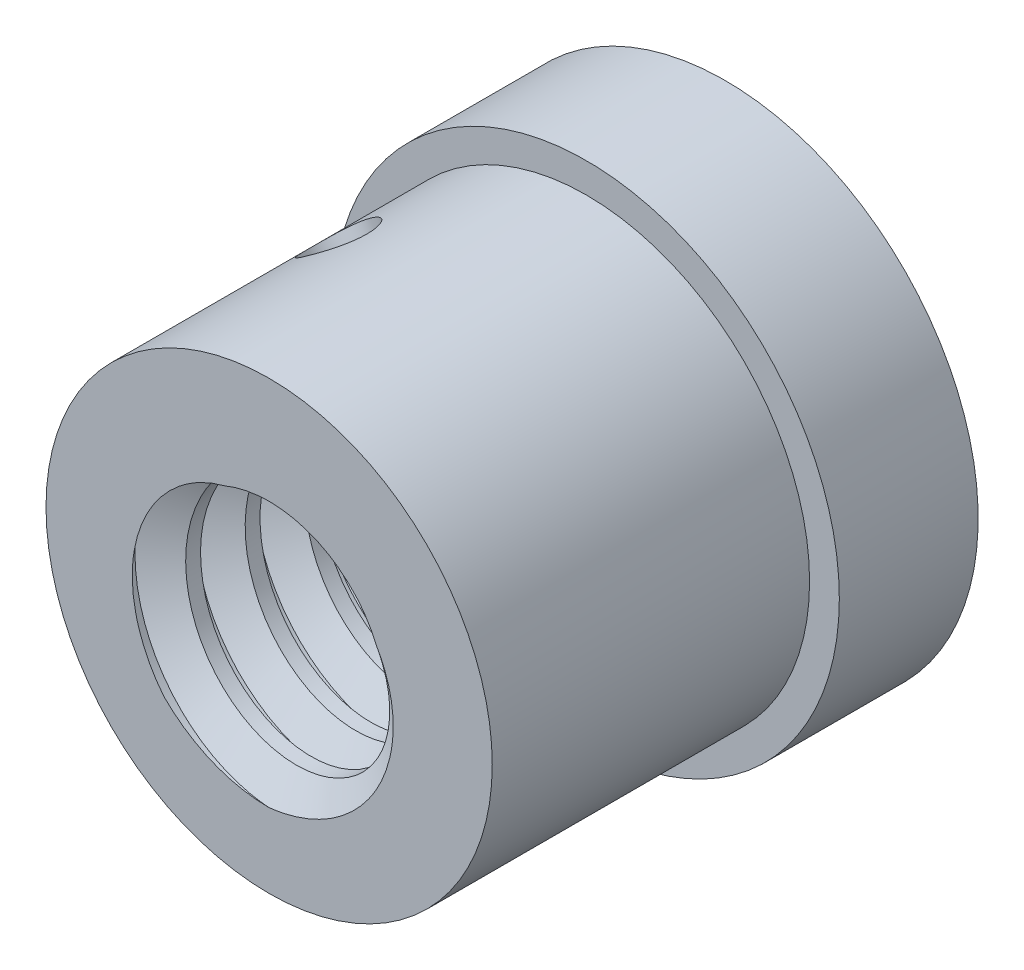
SolidWorks part; units mm, degrees
ref_plane "Спереди" through (0, 0, 0) normal (0, 0, 1) x (1, 0, 0)
ref_plane "Сверху" through (0, 0, 0) normal (0, 1, 0) x (1, 0, 0)
ref_plane "Справа" through (0, 0, 0) normal (1, 0, 0) x (0, 0, -1)
sketch "Эскиз1" plane through (0, 0, 0) normal (0, 0, 1) x (1, 0, 0)
  circle A0 centre (0, 0) radius 25.5
  dimension "D1" = 51
extrude "Бурт" add sketch "Эскиз1" along normal blind 14
sketch "Эскиз2" plane through (0, 0, 14) normal (0, 0, 1) x (1, 0, 0)
  circle A0 centre (0, 0) radius 22.5
extrude "Основное тело гайки" add sketch "Эскиз2" along normal blind 32
sketch "Эскиз3" plane through (0, 0, 46) normal (0, 0, 1) x (1, 0, 0)
  circle A0 centre (0, 0) radius 15
  dimension "D1" = 30
sketch "Ось" plane through (0, 0, 0) normal (0, 1, 0) x (1, 0, 0)
  line L0 (0, 2.476) -> (0, -49.1317) construction
extrude "Вырез-Вытянуть1" cut sketch "Эскиз3" against normal through all
thread "Резьба3" pitch 6 start angle 45, offset 5, length 0, pitch 6, diameter 30
ref_plane "Плоскость3" through (10.6066, 10.6066, -5) normal (0.7071, -0.7071, 0) x (0.7071, 0.7071, 0)
sketch "Профиль резьбы3" plane through (10.6066, 10.6066, -5) normal (0.7071, -0.7071, 0) x (0.7071, 0.7071, 0)
  line L0 (0, 0) -> (0, 6) construction
  line L11 (0, 0) -> (0, 5.25)
  line L12 (0, 5.25) -> (-3.2476, 3.375)
  line L13 (-3.2476, 3.375) -> (-3.2476, 1.875)
  line L15 (-3.2476, 1.875) -> (0, 0)
  line L17 (-3.2476, 2.625) -> (0, 2.625) construction
  point P2 (0, 0)
  dimension "Pitch" = 6
  dimension "Profile_Angle" = 60
  dimension "Profile_Land" = 1.5
  dimension "Profile_Height" = 3.2476
sketch "Эскиз26" plane through (0, 0, 46) normal (0, 0, -1) x (-1, 0, 0)
  circle A0 centre (0, 0) radius 22.5
extrude "Бобышка-Вытянуть2" add sketch "Эскиз26" against normal blind 10
sketch "Эскиз27" plane through (0, 0, 56) normal (0, 0, 1) x (1, 0, 0)
  circle A0 centre (0, 0) radius 22.5
extrude "Вырез-Вытянуть2" cut sketch "Эскиз27" against normal blind 10
sketch "Эскиз29" plane through (0, 0, 0) normal (0, 0, -1) x (-1, 0, 0)
  circle A0 centre (0, 0) radius 25.5
extrude "Бобышка-Вытянуть3" add sketch "Эскиз29" along normal blind 10
sketch "Эскиз30" plane through (0, 0, -10) normal (0, 0, -1) x (-1, 0, 0)
  circle A0 centre (0, 0) radius 25.5
extrude "Вырез-Вытянуть3" cut sketch "Эскиз30" against normal blind 10
hole_wizard "Отверстие обработанное метчиком M81" positions "Трехмерный эскиз3" profile "Эскиз32" tap size "M8" standard "GOST"
sketch3d "Трехмерный эскиз3"
  point P0 (-12.9351, 18.4101, 26.1209)
sketch "Эскиз32" plane through (-12.9351, 18.4101, 26.1209) normal (0, 0, 1) x (-0.8182, -0.5749, 0)
  line L0 (0, 0) -> (0, 15.8772)
  line L1 (0, 15.8772) -> (3.375, 13.8493)
  line L2 (3.375, 13.8493) -> (3.375, 0)
  line L5 (3.375, 0) -> (0, 0)
  line L10 (0, 15.8772) -> (-3.375, 13.8493) construction
  line L11 (0, -6.35) -> (0, 107.95) construction
  dimension "Диаметр сверла" = 6.75
  dimension "Глубина сверла" = 13.8493
  dimension "Угол заточки сверла" = 118
